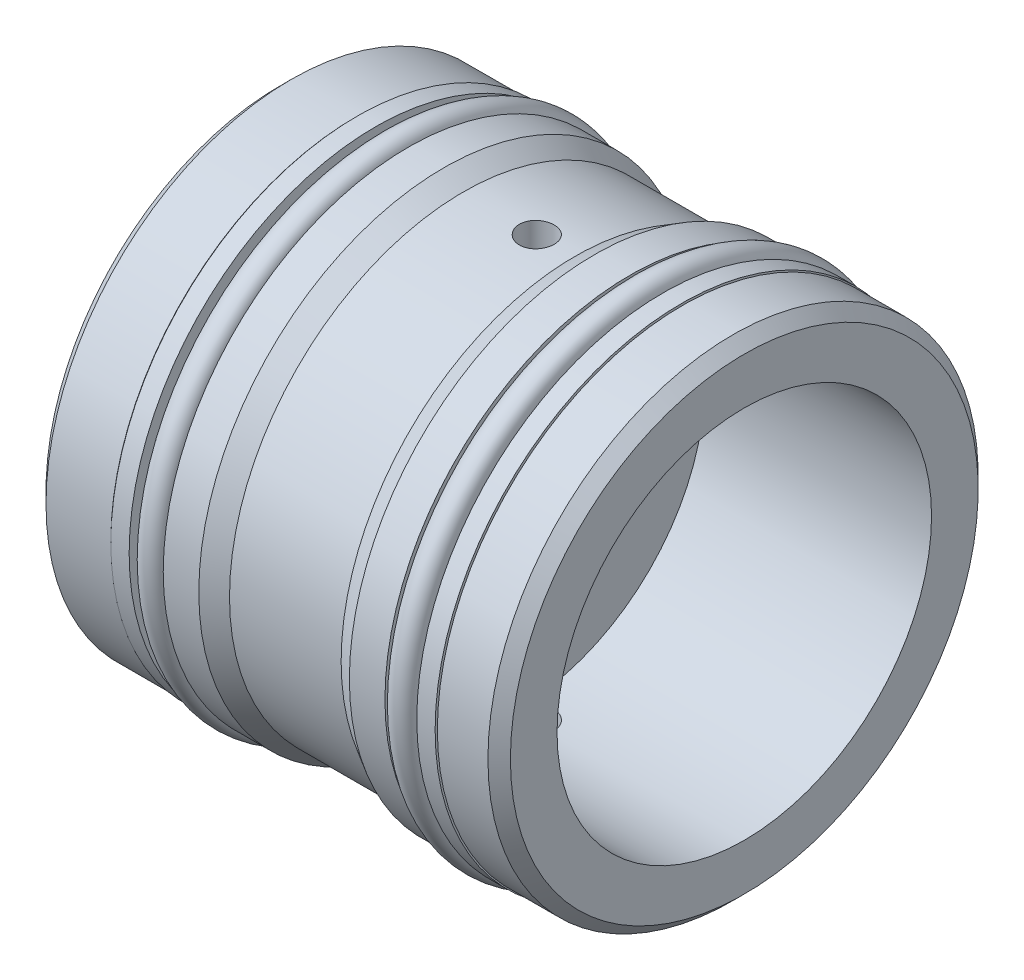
SolidWorks part; units mm, degrees
ref_plane "Front Plane" through (0, 0, 0) normal (0, 0, 1) x (1, 0, 0)
ref_plane "Top Plane" through (0, 0, 0) normal (0, 1, 0) x (1, 0, 0)
ref_plane "Right Plane" through (0, 0, 0) normal (1, 0, 0) x (0, 0, -1)
sketch "Sketch1" plane through (0, 0, 0) normal (0, 0, 1) x (1, 0, 0)
  line L0 (0, 0) -> (0, 45.5562) construction
  line L1 (0, 0) -> (32.8567, 0) construction
  line L2 (-15.748, 6.35) -> (-15.748, 16.6243)
  line L3 (-15.748, 16.6243) -> (-10.5918, 16.6243)
  line L4 (-10.5918, 16.6243) -> (-10.5918, 15.3543)
  line L5 (-10.5918, 15.3543) -> (-7.0358, 15.3543)
  line L6 (-7.0358, 15.3543) -> (-7.0358, 16.6243)
  line L7 (-7.0358, 16.6243) -> (-4.6228, 16.6243)
  line L8 (-4.6228, 16.6243) -> (-4.6228, 15.8623)
  line L9 (-4.6228, 15.8623) -> (5.588, 15.8623)
  line L10 (-15.748, 6.35) -> (0.3556, 6.35)
  line L11 (0.3556, 6.35) -> (0.3556, 12.7)
  line L12 (0.3556, 12.7) -> (15.748, 12.7)
  line L13 (5.588, 16.6243) -> (5.588, 15.8623)
  line L14 (8.001, 16.6243) -> (5.588, 16.6243)
  line L15 (8.001, 15.3543) -> (8.001, 16.6243)
  line L16 (11.557, 15.3543) -> (8.001, 15.3543)
  line L17 (11.557, 16.6243) -> (11.557, 15.3543)
  line L18 (15.748, 16.6243) -> (11.557, 16.6243)
  line L19 (15.748, 16.6243) -> (15.748, 12.7)
  dimension "D2" = 3.556
  dimension "D3" = 10.2108
  dimension "D4" = 33.2486
  dimension "D5" = 31.496
  dimension "D6" = 25.4
  dimension "D7" = 15.3924
  dimension "D8" = 31.7246
  dimension "D9" = 30.7086
  dimension "D10" = 12.7
  dimension "D11" = 26.3398
  dimension "D12" = 2.413
  dimension "D13" = 2.413
revolve "Revolve1" add sketch "Sketch1" angle 360 about L1
fillet "Fillet1" radius 0.381 2 edges at (5.588, 0, 15.8623) (-4.6228, 0, 15.8623)
chamfer "Chamfer1" distance 0.762 angle 45 2 edges at (15.748, 0, 16.6243) (-15.748, 0, 16.6243)
sketch "Sketch6" plane through (0, 0, 0) normal (0, 0, 1) x (1, 0, 0)
  line L0 (0, 0) -> (49.5791, 0) construction
  line L1 (-15.748, 15.8623) -> (-15.748, -15.8623) construction
  line L2 (-7.0358, 15.3543) -> (-10.5918, 15.3543) construction
  line L3 (-10.5156, 15.3543) -> (-9.271, 15.3543)
  line L4 (-10.5156, 15.3543) -> (-10.5156, 16.7005)
  line L5 (-10.5156, 16.7005) -> (-9.271, 16.7005)
  line L6 (-9.271, 15.3543) -> (-9.271, 16.7005)
  line L7 (0.4826, 41.4439) -> (0.4826, -9.3524) construction
  line L8 (-10.5918, -16.6243) -> (-10.5918, 16.6243) construction
  line L9 (11.557, 15.3543) -> (11.557, -15.3543) construction
  line L10 (-7.0358, 16.6243) -> (-7.0358, -16.6243) construction
  line L11 (10.2362, 15.3543) -> (10.2362, 16.7005)
  line L12 (11.4808, 16.7005) -> (10.2362, 16.7005)
  line L13 (11.4808, 15.3543) -> (11.4808, 16.7005)
  line L14 (11.4808, 15.3543) -> (10.2362, 15.3543)
  circle A0 centre (-8.001, 16.1671) radius 0.889
  circle A1 centre (8.9662, 16.1671) radius 0.889
  dimension "D4" = 1.778
  dimension "D5" = 32.3342
  dimension "D6" = 0.9652
  dimension "D1" = 1.2446
  dimension "D2" = 5.2324
  dimension "D3" = 33.401
revolve "Revolve3" add sketch "Sketch6" angle 360 about L0
sketch "Sketch7" plane through (0, 0, 0) normal (0, 1, 0) x (0, 0, -1)
  line L1 (-15.8623, -15.748) -> (15.8623, -15.748) construction
  circle A0 centre (0, -1.6764) radius 1.1811
  dimension "D1" = 2.3622
  dimension "D2" = 14.0716
extrude "Cut-Extrude1" cut sketch "Sketch7" against normal through all and the other way through all
sketch "Sketch8" plane through (0, 0, 0) normal (0, 0, 1) x (1, 0, 0)
  line L0 (0, 0) -> (21.6792, 0) construction
  line L1 (0.4826, 17.3392) -> (0.4826, -6.4291) construction
  line L2 (5.588, 16.6243) -> (5.588, -16.6243) construction
  line L3 (-4.6228, -16.2433) -> (-4.6228, 16.2433) construction
  line L4 (-4.6228, 16.6243) -> (-3.303, 15.8623)
  line L5 (0.4953, 15.8623) -> (-4.2418, 15.8623) construction
  line L6 (-3.303, 15.8623) -> (-4.6228, 15.8623)
  line L7 (-4.6228, 15.8623) -> (-4.6228, 16.6243)
  line L8 (5.588, 15.8623) -> (5.588, 16.6243)
  line L9 (4.2682, 15.8623) -> (5.588, 15.8623)
  line L10 (5.588, 16.6243) -> (4.2682, 15.8623)
  dimension "D1" = 30
revolve "Revolve4" add sketch "Sketch8" angle 360 about L0
